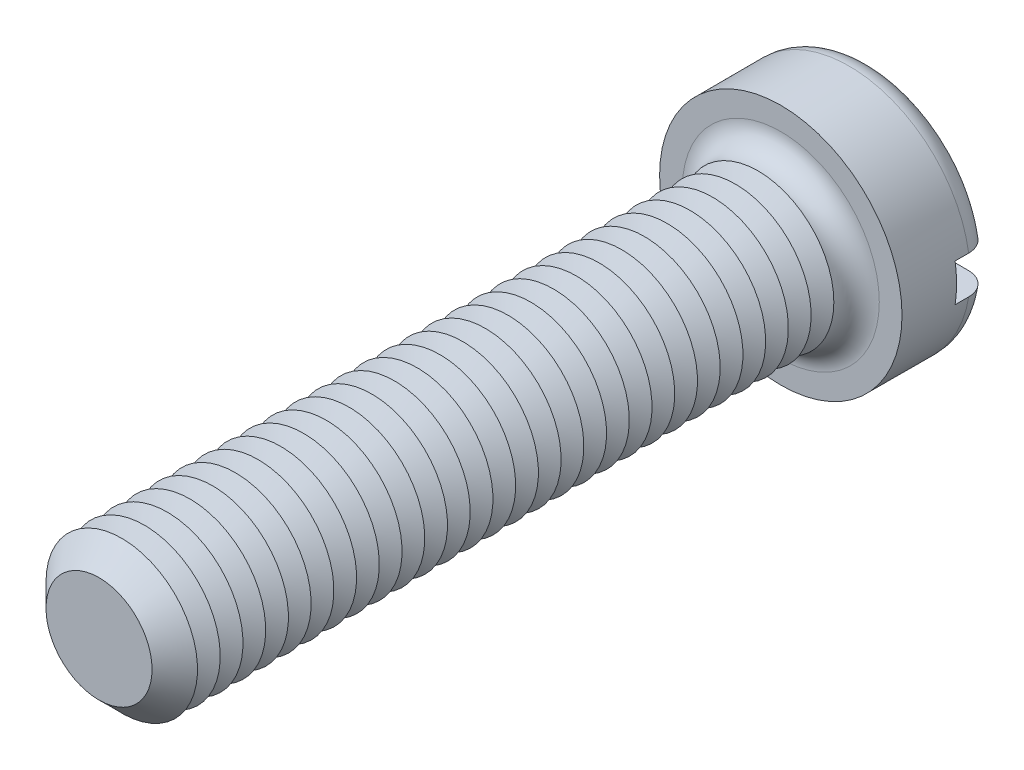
SolidWorks part; units mm, degrees
ref_plane "Front Plane" through (0, 0, 0) normal (0, 0, 1) x (1, 0, 0)
ref_plane "Top Plane" through (0, 0, 0) normal (0, 1, 0) x (1, 0, 0)
ref_plane "Right Plane" through (0, 0, 0) normal (1, 0, 0) x (0, 0, -1)
sketch "Sketch3" plane through (0, 0, 0) normal (0, 0, 1) x (1, 0, 0)
  circle A0 centre (0, 0) radius 8
  dimension "D1" = 16
extrude "Boss-Extrude2" add sketch "Sketch3" against normal blind 6
sketch "Sketch4" plane through (0, 0, 0) normal (0, 0, 1) x (1, 0, 0)
  circle A0 centre (0, 0) radius 5
  dimension "D1" = 10
extrude "Boss-Extrude3" add sketch "Sketch4" along normal blind 45
fillet "Fillet1" radius 1.5 2 edges at (8, 0, -6) (5, 0, 0)
chamfer "Chamfer1" distance 1.5 angle 45 1 edges at (5, 0, 45)
sketch "Sketch5" plane through (0, 0, 0) normal (1, 0, 0) x (0, 0, -1)
  line L0 (1.6944, 0) -> (-7.6738, 0) construction
sketch "Sketch6" plane through (0, 0, 0) normal (1, 0, 0) x (0, 0, -1)
  line L0 (-1.5, 5) -> (-2.25, 3.701)
  line L1 (-2.25, 3.701) -> (-3, 5)
  line L2 (-1.5, 5) -> (-43.5, 5) construction
  line L3 (-3, 5) -> (-1.5, 5)
  dimension "D1" = 1.5
revolve "Cut-Revolve1" cut sketch "Sketch6" angle 360 about L0
pattern_linear "LPattern1" count 28 spacing 1.5 along (0, 0, 1) of "Cut-Revolve1"
sketch "Sketch8" plane through (0, 0, -6) normal (0, 0, -1) x (-1, 0, 0)
  line L1 (8, -1.25) -> (-8, -1.25)
  line L2 (8, -1.25) -> (8, 1.25)
  line L3 (8, 1.25) -> (-8, 1.25)
  line L4 (-8, -1.25) -> (-8, 1.25)
  line L5 (8, -1.25) -> (-8, 1.25) construction
  line L6 (8, 1.25) -> (-8, -1.25) construction
  point P0 (0, 0)
  dimension "D1" = 16
  dimension "D2" = 2.5
extrude "Cut-Extrude1" cut sketch "Sketch8" against normal blind 2.4
